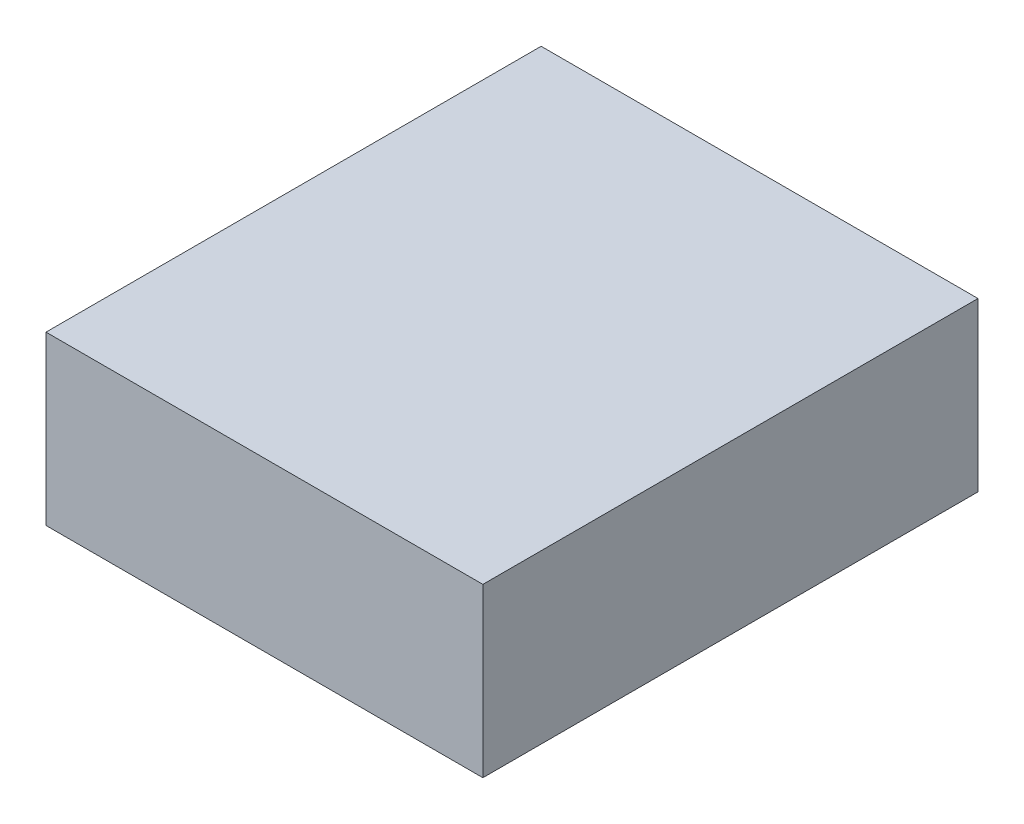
SolidWorks part; units mm, degrees
ref_plane "前视基准面" through (0, 0, 0) normal (0, 0, 1) x (1, 0, 0)
ref_plane "上视基准面" through (0, 0, 0) normal (0, 1, 0) x (1, 0, 0)
ref_plane "右视基准面" through (0, 0, 0) normal (1, 0, 0) x (0, 0, -1)
sketch "草图1" plane through (0, 0, 0) normal (0, 0, 1) x (1, 0, 0)
  line L1 (-15, 5.75) -> (15, 5.75)
  line L2 (-15, 5.75) -> (-15, -5.75)
  line L3 (-15, -5.75) -> (15, -5.75)
  line L4 (15, 5.75) -> (15, -5.75)
  line L5 (-15, 5.75) -> (15, -5.75) construction
  line L6 (-15, -5.75) -> (15, 5.75) construction
  point P0 (0, 0)
  dimension "D1" = 11.5
  dimension "D2" = 30
extrude "凸台-拉伸1" add sketch "草图1" along normal blind 34
